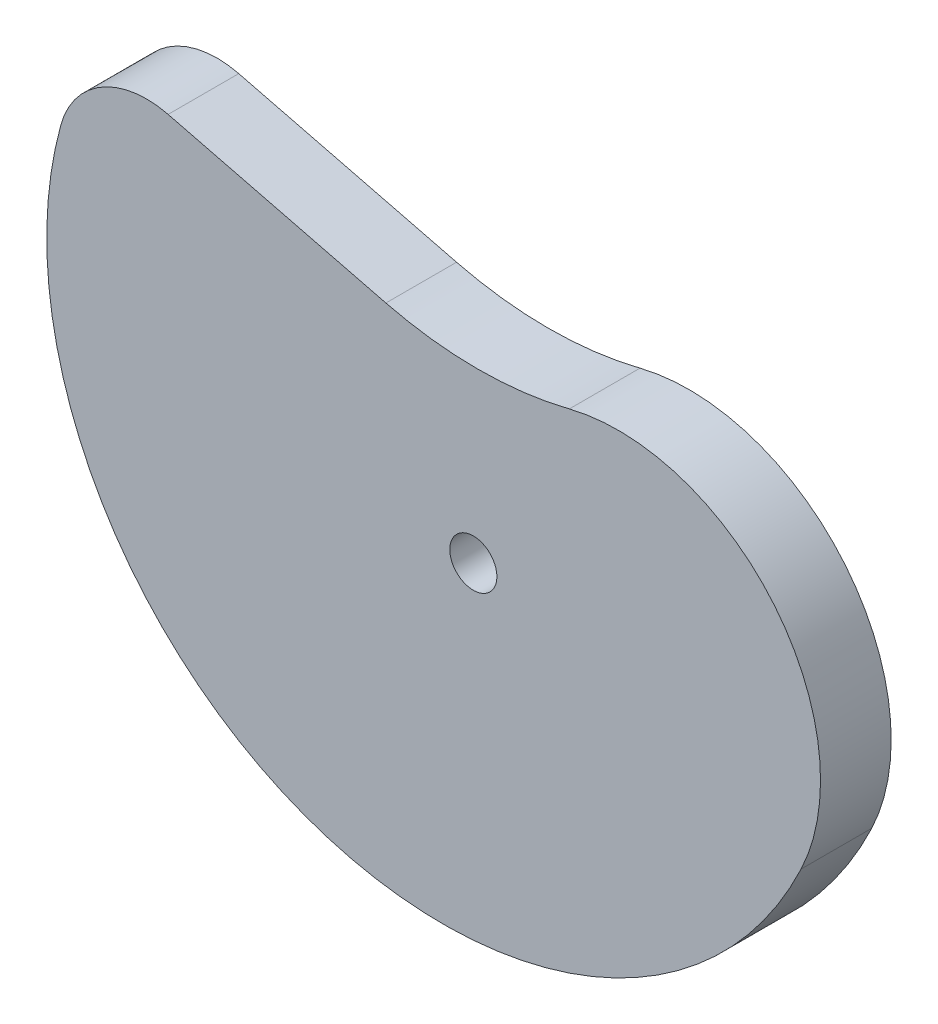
SolidWorks part; units mm, degrees
ref_plane "Front Plane" through (0, 0, 0) normal (0, 0, 1) x (1, 0, 0)
ref_plane "Top Plane" through (0, 0, 0) normal (0, 1, 0) x (1, 0, 0)
ref_plane "Right Plane" through (0, 0, 0) normal (1, 0, 0) x (0, 0, -1)
sketch "Sketch1" plane through (0, 0, 0) normal (0, 0, 1) x (1, 0, 0)
  circle A0 centre (0, 0) radius 6.35
  circle A1 centre (0, 0) radius 31.75
  dimension "D1" = 12.7
  dimension "D2" = 25.4
extrude "Extrude1" add sketch "Sketch1" along normal blind 19.05
sketch "Sketch2" plane through (0, 0, 19.05) normal (0, 0, 1) x (1, 0, 0)
  line L0 (-82.3061, 63.627) -> (-23.5799, 48.9455)
  circle A0 centre (0, 0) radius 31.75 construction
  circle A1 centre (0, 0) radius 31.75
  arc A2 (-23.5799, 48.9455) -> (25.8899, 48.9455) centre (1.155, 147.885) ccw
  arc A3 (25.8899, 48.9455) -> (88.3832, -27.2672) centre (39.1115, -3.9411) cw
  arc A4 (88.3832, -27.2672) -> (-111.2246, 46.7213) centre (-8.1871, 18.4508) cw
  arc A5 (-111.2246, 46.7213) -> (-82.3061, 63.627) centre (-88.1175, 40.3814) cw
extrude "Extrude2" add sketch "Sketch2" against normal up to surface (19.05 mm away)
